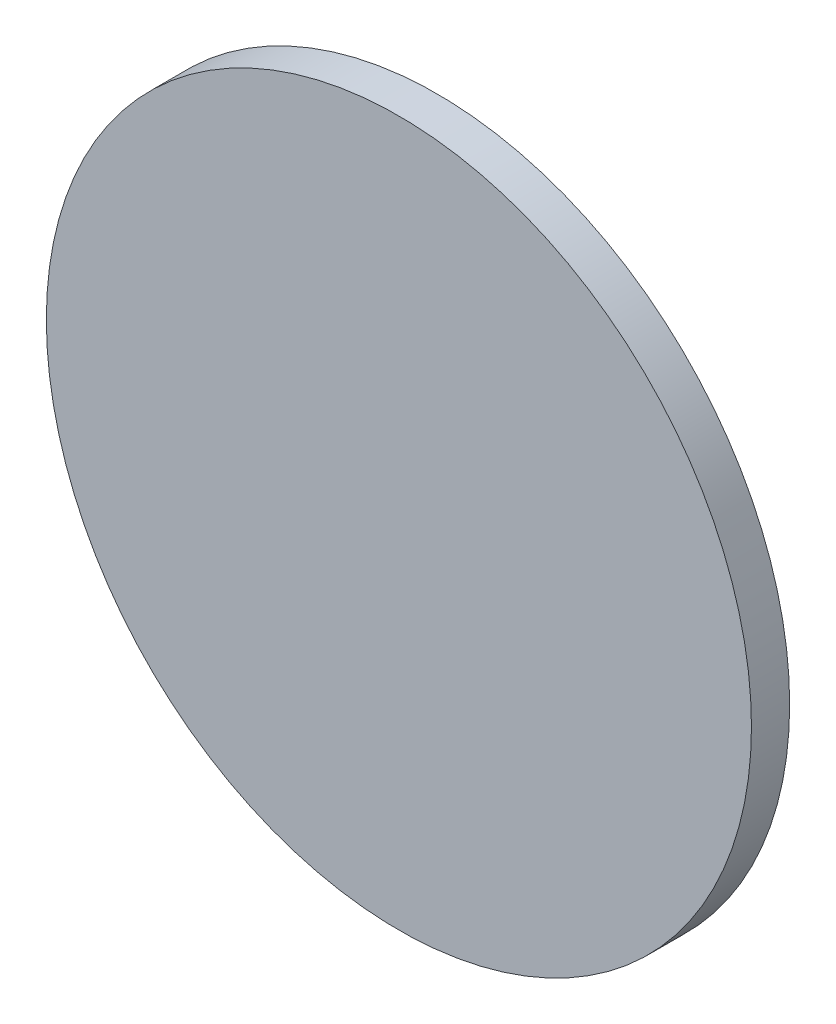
SolidWorks part; units mm, degrees
ref_plane "Front Plane" through (0, 0, 0) normal (0, 0, 1) x (1, 0, 0)
ref_plane "Top Plane" through (0, 0, 0) normal (0, 1, 0) x (1, 0, 0)
ref_plane "Right Plane" through (0, 0, 0) normal (1, 0, 0) x (0, 0, -1)
sketch "Sketch1" plane through (0, 0, 0) normal (0, 0, 1) x (1, 0, 0)
  circle A0 centre (0, 0) radius 46.139
extrude "Extrude1" add sketch "Sketch1" along normal blind 5
